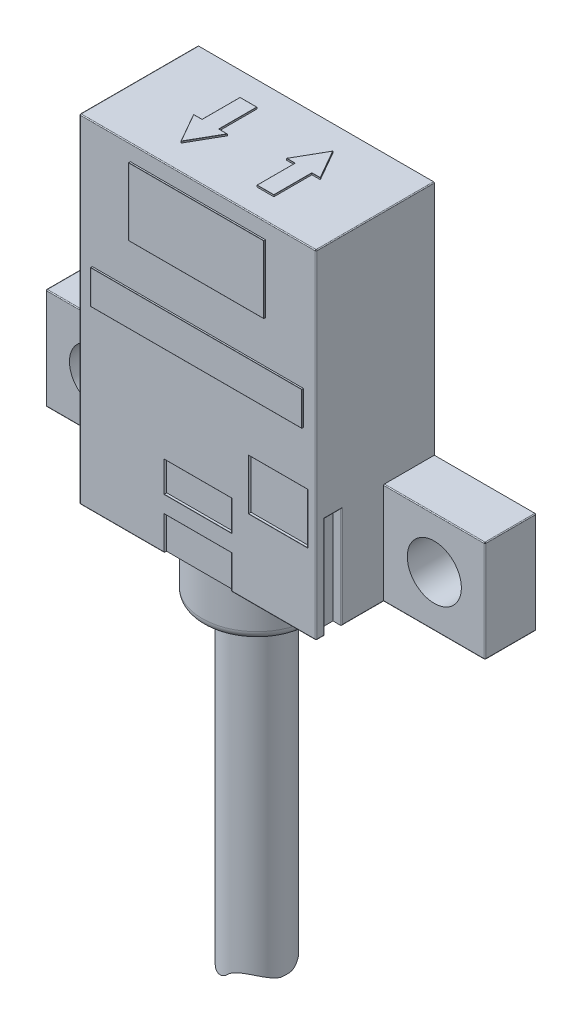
SolidWorks part; units mm, degrees
ref_plane "前视基准面" through (0, 0, 0) normal (0, 0, 1) x (1, 0, 0)
ref_plane "上视基准面" through (0, 0, 0) normal (0, 1, 0) x (1, 0, 0)
ref_plane "右视基准面" through (0, 0, 0) normal (1, 0, 0) x (0, 0, -1)
sketch "草图2" plane through (0, 0, 0) normal (0, 0, 1) x (1, 0, 0)
  line L0 (-7, 20) -> (7, 20)
  line L1 (7, 20) -> (7, 6)
  line L2 (7, 6) -> (13, 6)
  line L3 (13, 6) -> (13, 0)
  line L4 (13, 0) -> (-13, 0)
  line L5 (-13, 0) -> (-13, 6)
  line L6 (-13, 6) -> (-7, 6)
  line L7 (-7, 6) -> (-7, 20)
  line L8 (-1000, 0) -> (49000, 0) construction
  line L9 (0, -1000) -> (0, 49000) construction
  circle A0 centre (-10, 3) radius 1.6
  circle A1 centre (10, 3) radius 1.6
  dimension "D5" = 20
  dimension "D6" = 3.2
  dimension "D1" = 14
  dimension "D2" = 26
  dimension "D3" = 14
  dimension "D4" = 20
  dimension "D7" = 3
extrude "凸台-拉伸1" add sketch "草图2" along normal mid plane 7
sketch "草图3" plane through (0, 0, 3.5) normal (0, 0, 1) x (1, 0, 0)
  line L0 (-7, 6) -> (-7, 0)
  line L1 (-13, 0) -> (13, 0) construction
  line L2 (-7, 0) -> (-14.9747, 0)
  line L3 (-14.9747, 0) -> (-14.9747, 6)
  line L4 (-14.9747, 6) -> (-7, 6)
  line L5 (-7, 20) -> (-7, 6) construction
  dimension "D1" = 7.9747
extrude "切除-拉伸1" cut sketch "草图3" against normal blind 4
mirror "镜向1" about plane through (0, 0, 0) normal (1, 0, 0) of "切除-拉伸1"
sketch "草图4" plane through (0, 0, 3.5) normal (0, 0, 1) x (1, 0, 0)
  line L0 (0, -982.9504) -> (0, 49017.0496) construction
  line L1 (-4, 19.0496) -> (4, 19.0496)
  line L2 (-4, 19.0496) -> (-4, 15.0496)
  line L3 (-4, 15.0496) -> (4, 15.0496)
  line L4 (4, 19.0496) -> (4, 15.0496)
  line L5 (-4, 19.0496) -> (4, 15.0496) construction
  line L6 (-4, 15.0496) -> (4, 19.0496) construction
  point P0 (0, 17.0496)
  dimension "D1" = 8
  dimension "D2" = 4
extrude "凸台-拉伸2" add sketch "草图4" along normal blind 0.1
sketch "草图5" plane through (0, 0, 0) normal (0, -1, 0) x (1, 0, 0)
  circle A0 centre (0, 0) radius 3.25
  dimension "D1" = 6.5
extrude "凸台-拉伸3" add sketch "草图5" along normal blind 3
sketch "草图6" plane through (0, -3, 0) normal (0, -1, 0) x (1, 0, 0)
  circle A0 centre (0, 0) radius 1.75
  dimension "D1" = 3.5
extrude "凸台-拉伸4" add sketch "草图6" along normal blind 37
sketch "草图7" plane through (0, 0, 3.5) normal (0, 0, 1) x (1, 0, 0)
  line L0 (-1.75, -3) -> (-1.75, -40) construction
  arc A0 (-1.75, -21.5) -> (0, -21.5) centre (-0.875, -20.625) ccw
  arc A1 (0, -21.5) -> (1.7181, -21.5) centre (0.859, -22.359) cw
extrude "切除-拉伸2" cut sketch "草图7" against normal through all and the other way through all flip side to cut
sketch "草图8" plane through (0, 20, 0) normal (0, 1, 0) x (1, 0, 0)
  line L0 (0, -1000) -> (0, 49000) construction
  line L1 (-1000, 0) -> (49000, 0) construction
  line L2 (2.5, 2) -> (3.5, 0.25)
  line L3 (3.5, 0.25) -> (3, 0.25)
  line L4 (3, 0.25) -> (3, -2)
  line L5 (3, -2) -> (2, -2)
  line L6 (2, -2) -> (2, 0.25)
  line L7 (2, 0.25) -> (1.5, 0.25)
  line L8 (1.5, 0.25) -> (2.5, 2)
  line L9 (2.5, -1000.9657) -> (2.5, -998.7157) construction
  line L10 (7, 3.5) -> (-7, 3.5) construction
  line L11 (-1.5, -0.25) -> (-2.5, -2)
  line L12 (-2, 1.9992) -> (-2, -0.25)
  line L13 (-3, -0.25) -> (-3, 1.9992)
  line L14 (-2, -0.25) -> (-1.5, -0.25)
  line L15 (-3, 1.9992) -> (-2, 1.9992)
  line L16 (-3.5, -0.25) -> (-3, -0.25)
  line L17 (-2.5, -2) -> (-3.5, -0.25)
  line L18 (-2.5, -998) -> (-2.5, 49002) construction
  line L19 (7, -3.5) -> (-7, -3.5) construction
  point P26 (-2.5, 1.9992)
  dimension "D1" = 4
  dimension "D2" = 2
  dimension "D3" = 1.75
  dimension "D4" = 1
  dimension "D5" = 2.5
  dimension "D6" = 1.5
  dimension "D7" = 2.5
  dimension "D8" = 1
  dimension "D9" = 1.75
  dimension "D10" = 2
  dimension "D11" = 3.9992
  dimension "D12" = 1.5
extrude "凸台-拉伸5" add sketch "草图8" along normal blind 0.1
sketch "草图10" plane through (0, 0, 3.5) normal (0, 0, 1) x (1, 0, 0)
  line L0 (0, -1000) -> (0, 49000) construction
  line L1 (-7, 0) -> (7, 0) construction
  line L2 (-2, 3) -> (2, 3)
  line L3 (-2, 3) -> (-2, 4.8)
  line L4 (-2, 4.8) -> (2, 4.8)
  line L5 (2, 3) -> (2, 4.8)
  line L6 (-2, 3) -> (2, 4.8) construction
  line L7 (-2, 4.8) -> (2, 3) construction
  line L8 (-2, 2) -> (2, 2)
  line L9 (-2, 2) -> (-2, 0)
  line L10 (-2, 0) -> (2, 0)
  line L11 (2, 2) -> (2, 0)
  line L12 (-2, 2) -> (2, 0) construction
  line L13 (-2, 0) -> (2, 2) construction
  point P1 (0, 3.9)
  point P8 (0, 1)
  dimension "D1" = 4
  dimension "D2" = 1.8
  dimension "D3" = 1
  dimension "D4" = 2
extrude "切除-拉伸6" cut sketch "草图10" against normal blind 0.15 contours L4 L5 L2 L3 | L11 L10 L9 L8
sketch "草图11" plane through (0, 0, 3.5) normal (0, 0, 1) x (1, 0, 0)
  line L0 (7, 0) -> (7, 20) construction
  line L1 (3, 7.5) -> (6.5, 7.5)
  line L2 (3, 7.5) -> (3, 4.5)
  line L3 (3, 4.5) -> (6.5, 4.5)
  line L4 (6.5, 7.5) -> (6.5, 4.5)
  line L5 (3, 7.5) -> (6.5, 4.5) construction
  line L6 (3, 4.5) -> (6.5, 7.5) construction
  line L7 (2, 0) -> (7, 0) construction
  point P0 (4.75, 6)
  dimension "D1" = 3.5
  dimension "D2" = 3
  dimension "D3" = 0.5
  dimension "D4" = 4.5
extrude "切除-拉伸8" cut sketch "草图11" against normal blind 0.15 contours L1 L4 L3 L2
sketch "草图12" plane through (-7, 0, 0) normal (-1, 0, 0) x (0, 0, 1)
  line L0 (3, 6) -> (3, 0)
  line L1 (-0.5, 0) -> (3.5, 0) construction
  line L2 (3, 0) -> (2, 0)
  line L3 (2, 0) -> (2, 6)
  line L4 (2, 6) -> (3, 6)
  line L5 (3.5, 20) -> (-3.5, 20) construction
  line L6 (3.5, 20) -> (3.5, 0) construction
  dimension "D1" = 14
  dimension "D2" = 1
  dimension "D3" = 0.5
extrude "切除-拉伸9" cut sketch "草图12" against normal blind 0.5
mirror "镜向2" about plane through (0, 0, 0) normal (1, 0, 0) of "切除-拉伸9"
sketch "草图13" plane through (0, 0, 3.5) normal (0, 0, 1) x (1, 0, 0)
  line L0 (-4, 15.0496) -> (4, 15.0496) construction
  line L1 (6.25, 10.5496) -> (-6.25, 10.5496)
  line L2 (6.25, 10.5496) -> (6.25, 12.5496)
  line L3 (6.25, 12.5496) -> (-6.25, 12.5496)
  line L4 (-6.25, 10.5496) -> (-6.25, 12.5496)
  line L5 (6.25, 10.5496) -> (-6.25, 12.5496) construction
  line L6 (6.25, 12.5496) -> (-6.25, 10.5496) construction
  point P0 (0, 11.5496)
  dimension "D1" = 2
  dimension "D2" = 12.5
  dimension "D3" = 2.5
extrude "凸台-拉伸6" add sketch "草图13" along normal blind 0.1
fillet "圆角1" radius 0.05 27 edges at (-7, 0, 3.25) (7, 0, 3.25) (-7, 0, 0.75) (7, 0, 0.75) (13, 6, -2) (13, 0, -2) (7, 20, 0) (-7, 20, 0) (-13, 0, -2) (-13, 6, -2) (7, 6, 2.5) (7, 3, 2) (7, 3, 3) (-7, 3, 2) (-7, 6, 2.5) (-7, 3, 3) (10, 0, -0.5) (13, 3, -0.5) (10, 6, -0.5) (-10, 0, -0.5) (-10, 6, -0.5) (-13, 3, -0.5) (4.5, 0, 3.5) (-4.5, 0, 3.5) (-7, 10, 3.5) (0, 20, 3.5) (7, 10, 3.5)
fillet "圆角2" radius 0.01 37 edges at (-2, 0, 3.4) (-2, 0.0146, 3.4854) (2, 0, 3.4) (2, 0.0146, 3.4854) (0, 12.5496, 3.6) (6.25, 11.5496, 3.6) (0, 10.5496, 3.6) (-6.25, 11.5496, 3.6) (0, 15.0496, 3.6) (-4, 17.0496, 3.6) (0, 19.0496, 3.6) (4, 17.0496, 3.6) (3, 20.1, -1.125) (3.25, 20.1, -0.25) (3, 20.1, 0.875) (2.5, 20.1, 2) (2, 20.1, 0.875) (1.75, 20.1, -0.25) (2, 20.1, -1.125) (-3.25, 20.1, 0.25) (-3, 20.1, -0.8746) (-2.5, 20.1, -1.9992) (-2, 20.1, -0.8746) (-1.75, 20.1, 0.25) (-2, 20.1, 1.125) (-3, 20.1, 1.125) (-2, 1.025, 3.5) (0, 2, 3.5) (2, 1.025, 3.5) (6.5, 6, 3.5) (4.75, 7.5, 3.5) (4.75, 4.5, 3.5) (3, 6, 3.5) (-2, 3.9, 3.5) (0, 3, 3.5) (0, 4.8, 3.5) (2, 3.9, 3.5)
fillet "圆角3" radius 0.5 1 edges at (0, -3, -3.25)
